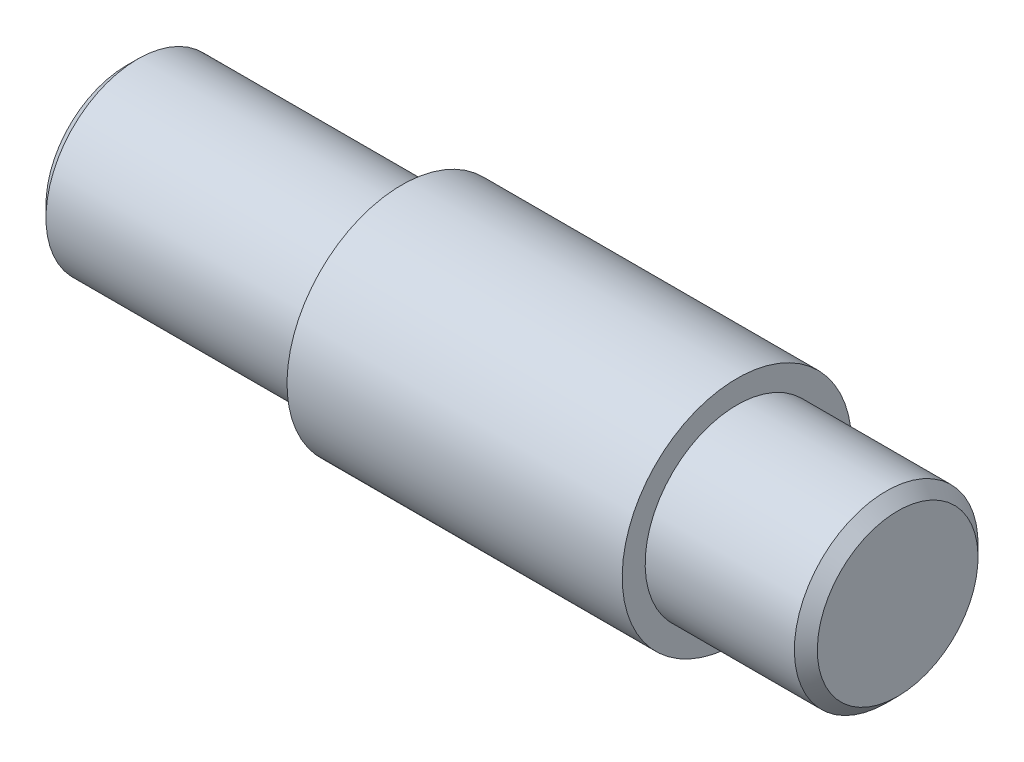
SolidWorks part; units mm, degrees
ref_plane "Plan de face" through (0, 0, 0) normal (0, 0, 1) x (1, 0, 0)
ref_plane "Plan de dessus" through (0, 0, 0) normal (0, 1, 0) x (1, 0, 0)
ref_plane "Plan de droite" through (0, 0, 0) normal (1, 0, 0) x (0, 0, -1)
sketch "Esquisse1" plane through (0, 0, 0) normal (0, 0, 1) x (1, 0, 0)
  line L0 (0, 0) -> (16.8, 0)
  line L1 (16.8, 0) -> (16.8, 2)
  line L2 (16.8, 2) -> (13.3, 2)
  line L3 (13.3, 2) -> (13.3, 2.5)
  line L4 (13.3, 2.5) -> (6, 2.5)
  line L5 (6, 2.5) -> (6, 2)
  line L6 (6, 2) -> (0, 2)
  line L7 (0, 2) -> (0, 0)
  dimension "D1" = 7.3
  dimension "D2" = 3.5
  dimension "D3" = 6
  dimension "D4" = 2
  dimension "D5" = 2.5
  dimension "D6" = 2
revolve "Révolution1" add sketch "Esquisse1" angle 360 about L0
sketch "Esquisse2" plane through (0, 0, 0) normal (-1, 0, 0) x (0, 0, 1)
  circle A0 centre (0, 0) radius 0.5
  dimension "D1" = 1
extrude "Enlèv. mat.-Extru.1" cut sketch "Esquisse2" against normal blind 1
chamfer "Chanfrein1" distance 0.25 angle 45 2 edges at (16.8, -2, 0) (0, -2, 0)
